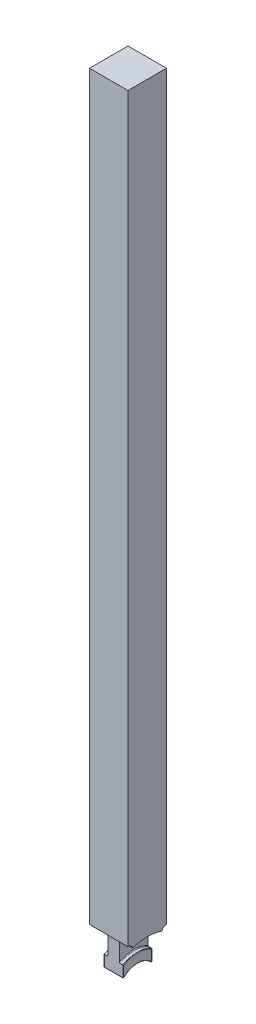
SolidWorks part; units mm, degrees
ref_plane "Front Plane" through (0, 0, 0) normal (0, 0, 1) x (1, 0, 0)
ref_plane "Top Plane" through (0, 0, 0) normal (0, 1, 0) x (1, 0, 0)
ref_plane "Right Plane" through (0, 0, 0) normal (1, 0, 0) x (0, 0, -1)
sketch "Sketch1" plane through (0, 0, 0) normal (1, 0, 0) x (0, 0, -1)
  line L0 (-10, 410) -> (-10, 0)
  line L1 (0, 249.2329) -> (0, 0) construction
  line L2 (10, 410) -> (10, 0)
  line L3 (-10, 410) -> (10, 410)
  line L6 (-10, 0) -> (10, 0)
  arc A0 (-10, 0) -> (10, 0) centre (0, 0) cw construction
  dimension "R" = 10
  dimension "L" = 400
  dimension "T" = 20
extrude "Boss-Extrude1" add sketch "Sketch1" along normal mid plane 20
sketch "Sketch8" plane through (0, 0, 0) normal (1, 0, 0) x (0, 0, -1)
  circle A0 centre (0, 0) radius 10
  arc A1 (10, 0) -> (-10, 0) centre (0, 0) ccw construction
extrude "Cut-Extrude4" cut sketch "Sketch8" against normal through all both and the other way through all
sketch "Sketch2" plane through (0, 0, 0) normal (0, 0, 1) x (1, 0, 0)
  line L0 (10, 15) -> (3, 15)
  line L1 (10, 410) -> (10, 0) construction
  line L2 (3, 15) -> (3, 24.5)
  line L3 (3, 24.5) -> (10, 24.5)
  line L4 (10, 24.5) -> (10, 15)
  line L5 (0, 29.9173) -> (0, 0) construction
  line L6 (-10, 24.5) -> (-10, 15)
  line L7 (-3, 24.5) -> (-10, 24.5)
  line L8 (-3, 15) -> (-3, 24.5)
  line L9 (-10, 15) -> (-3, 15)
  line L10 (-8.8482, 0) -> (24.5305, 0) construction
  dimension "D1" = 6
  dimension "D2" = 24.5
  dimension "D3" = 15
revolve "Cut-Revolve1" cut sketch "Sketch2" angle 360 about L10
sketch "Sketch6" plane through (0, 0, 0) normal (1, 0, 0) x (0, 0, -1)
  line L0 (0, 19.903) -> (0, 0) construction
  line L1 (7.5, 0) -> (26.55, 0)
  line L2 (7.5, 0) -> (7.5, 22.6124)
  line L3 (9.8876, 25) -> (26.55, 25)
  line L4 (26.55, 0) -> (26.55, 25)
  line L9 (-7.5, 0) -> (-26.55, 0)
  line L10 (-26.55, 0) -> (-26.55, 25)
  line L11 (-9.8876, 25) -> (-26.55, 25)
  line L12 (-7.5, 0) -> (-7.5, 22.6124)
  arc A0 (7.5, 22.6124) -> (9.8876, 25) centre (9.8876, 22.6124) cw
  arc A1 (-7.5, 22.6124) -> (-9.8876, 25) centre (-9.8876, 22.6124) ccw
  dimension "D3" = 2.3876
  dimension "D1" = 25
  dimension "MT" = 15
  dimension "D2" = 19.05
extrude "Cut-Extrude2" cut sketch "Sketch6" against normal through all both and the other way through all
sketch "Sketch7" plane through (0, 0, 0) normal (0, 0, 1) x (1, 0, 0)
  line L6 (-10, 15) -> (-5, 15)
  line L8 (-10, 15) -> (-10, 0)
  line L9 (-10, 0) -> (-5, 0)
  line L10 (-5, 15) -> (-5, 0)
  line L11 (0, 16.5651) -> (0, 5.9342) construction
  line L12 (5, 15) -> (5, 0)
  line L13 (10, 0) -> (5, 0)
  line L14 (10, 15) -> (10, 0)
  line L15 (10, 15) -> (5, 15)
  dimension "MW" = 10
extrude "Cut-Extrude3" cut sketch "Sketch7" against normal through all both and the other way through all
fillet "Fillet1" radius 0.762 2 edges at (-3, 24.5, 0) (3, 24.5, 0)
fillet "Fillet2" radius 0.381 2 edges at (-3, 15, 0) (3, 15, 0)
fillet "Fillet3" radius 0.254 10 edges at (5, 9.8024, -7.5) (5, 9.8024, 7.5) (5, 15, 0) (-5, 9.8024, 7.5) (-5, 9.8024, -7.5) (-5, 15, 0) (5, 10, 0) (-5, 10, 0) (0, 6.6144, -7.5) (0, 6.6144, 7.5)
